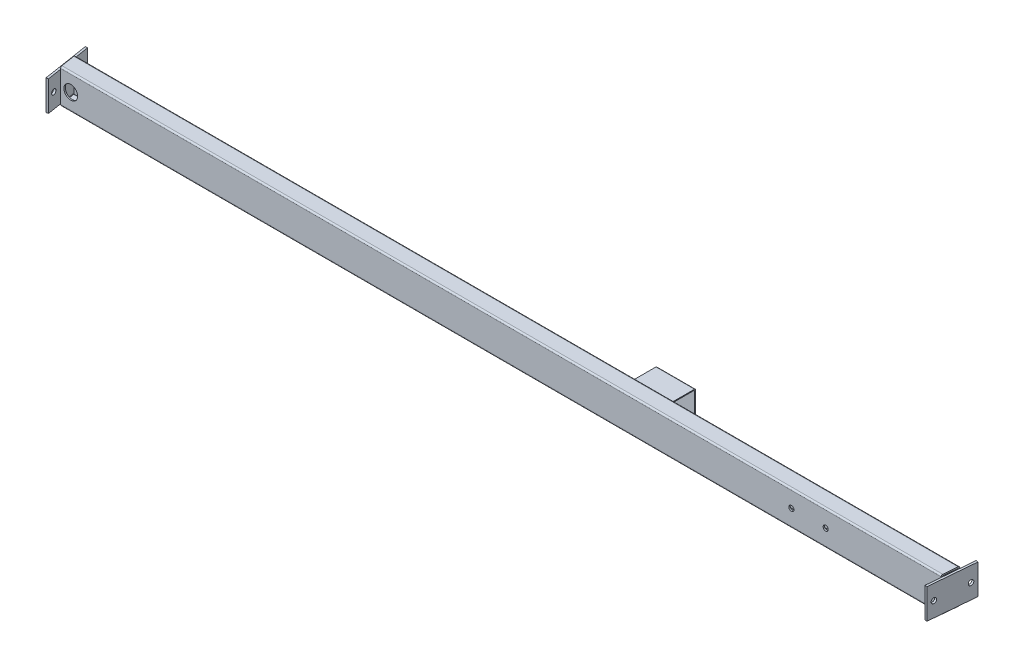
SolidWorks part; units mm, degrees
ref_plane "Plan de face" through (0, 0, 0) normal (0, 0, 1) x (1, 0, 0)
ref_plane "Plan de dessus" through (0, 0, 0) normal (0, 1, 0) x (1, 0, 0)
ref_plane "Plan de droite" through (0, 0, 0) normal (1, 0, 0) x (0, 0, -1)
sketch3d "Esquisse3D1"
  line L0 (0, 0, 0) -> (2065, 0, 0)
  dimension "D1" = 2065
other "Elément mécano-soudé1"
ref_plane "Plan1" through (0, 0, 0) normal (1, 0, 0) x (0, 0, -1)
sketch "Sketch1" plane through (0, 0, 0) normal (1, 0, 0) x (0, 0, -1)
  line L0 (-16.5, -36.8) -> (16.5, -36.8)
  line L1 (-16.8, -36.5) -> (-16.8, 36.5)
  line L2 (16.5, 36.8) -> (-16.5, 36.8)
  line L3 (16.8, 36.5) -> (16.8, -36.5)
  line L4 (-16.5, -40) -> (16.5, -40)
  line L5 (-20, -36.5) -> (-20, 36.5)
  line L6 (16.5, 40) -> (-16.5, 40)
  line L7 (20, 36.5) -> (20, -36.5)
  arc A0 (20, 36.5) -> (16.5, 40) centre (16.5, 36.5) ccw
  arc A1 (16.5, -40) -> (20, -36.5) centre (16.5, -36.5) ccw
  arc A2 (-20, -36.5) -> (-16.5, -40) centre (-16.5, -36.5) ccw
  arc A3 (-16.5, 40) -> (-20, 36.5) centre (-16.5, 36.5) ccw
  arc A4 (-16.5, 36.8) -> (-16.8, 36.5) centre (-16.5, 36.5) ccw
  arc A5 (16.8, 36.5) -> (16.5, 36.8) centre (16.5, 36.5) ccw
  arc A6 (16.5, -36.8) -> (16.8, -36.5) centre (16.5, -36.5) ccw
  arc A7 (-16.8, -36.5) -> (-16.5, -36.8) centre (-16.5, -36.5) ccw
  point P0 (0, 40)
  point P1 (20, 0)
  point P2 (0, -40)
  point P3 (-20, 0)
  point P4 (-20, 40)
  point P5 (20, 40)
  point P6 (20, -40)
  point P7 (-20, -40)
  point P8 (0, 0)
  point P33 (0, 0)
  dimension "D1" = 3.5
  dimension "Thickness" = 3.2
  dimension "V_leg" = 80
  dimension "H_leg" = 40
ref_plane "Plan2" through (2047.5775, 0, 179.1398) normal (0.9962, 0, 0.0872) x (0.0872, 0, -0.9962)
sketch "Esquisse2" plane through (2047.5775, 0, 179.1398) normal (0.9962, 0, 0.0872) x (0.0872, 0, -0.9962)
  line L0 (199.9005, -36.5) -> (199.9005, 36.5) construction
  line L1 (229.9005, 70) -> (130.0527, 70)
  line L2 (229.9005, 70) -> (229.9005, -70)
  line L3 (229.9005, -70) -> (130.0527, -70)
  line L4 (130.0527, 70) -> (130.0527, -70)
  line L5 (163.5394, -40) -> (196.4138, -40) construction
  line L6 (196.4138, 40) -> (163.5394, 40) construction
  line L7 (160.0527, 36.5) -> (160.0527, -36.5) construction
  point P6 (179.9766, -40)
  dimension "D1" = 30
  dimension "D2" = 30
  dimension "D3" = 30
  dimension "D4" = 30
extrude "Enlèv. mat.-Extru.1" cut sketch "Esquisse2" along normal blind 10
ref_plane "Plan3" through (3.0902, 0, -0.4894) normal (-0.9877, 0, 0.1564) x (0.1564, 0, 0.9877)
sketch "Esquisse3" plane through (3.0902, 0, -0.4894) normal (-0.9877, 0, 0.1564) x (0.1564, 0, 0.9877)
  line L0 (19.7538, 36.5) -> (19.7538, -36.5) construction
  line L1 (-49.7538, 70) -> (49.7538, 70)
  line L2 (-49.7538, 70) -> (-49.7538, -70)
  line L3 (-49.7538, -70) -> (49.7538, -70)
  line L4 (49.7538, 70) -> (49.7538, -70)
  line L5 (16.2969, -40) -> (-16.2969, -40) construction
  line L6 (-16.2969, 40) -> (16.2969, 40) construction
  line L7 (-19.7538, -36.5) -> (-19.7538, 36.5) construction
  dimension "D1" = 30
  dimension "D2" = 30
  dimension "D3" = 30
  dimension "D4" = 30
extrude "Enlèv. mat.-Extru.3" cut sketch "Esquisse3" along normal blind 208
sketch "Esquisse4" plane through (3.0902, 0, -0.4894) normal (-0.9877, 0, 0.1564) x (0.1564, 0, 0.9877)
  line L1 (-55, -35) -> (55, -35)
  line L2 (-55, -35) -> (-55, 35)
  line L3 (-55, 35) -> (55, 35)
  line L4 (55, -35) -> (55, 35)
  circle A0 centre (-40, 0) radius 6
  circle A1 centre (40, 0) radius 6
  dimension "D5" = 12
  dimension "D1" = 70
  dimension "D2" = 110
  dimension "D3" = 55
  dimension "D4" = 35
  dimension "D6" = 15
  dimension "D7" = 15
extrude "Boss.-Extru.1" add sketch "Esquisse4" along normal blind 5 separate body
sketch "Esquisse5" plane through (2047.5775, 0, 179.1398) normal (0.9962, 0, 0.0872) x (0.0872, 0, -0.9962)
  line L1 (234.9766, 35) -> (124.9766, 35)
  line L2 (234.9766, 35) -> (234.9766, -35)
  line L3 (234.9766, -35) -> (124.9766, -35)
  line L4 (124.9766, 35) -> (124.9766, -35)
  circle A0 centre (219.9766, 0) radius 6
  circle A1 centre (139.9766, 0) radius 6
  dimension "D5" = 12
  dimension "D1" = 70
  dimension "D2" = 110
  dimension "D3" = 35
  dimension "D4" = 55
  dimension "D6" = 15
  dimension "D7" = 15
extrude "Boss.-Extru.2" add sketch "Esquisse5" along normal blind 5 separate body
sketch "Esquisse6" plane through (0, 0, -20) normal (0, 0, -1) x (-1, 0, 0)
  line L0 (-2065, -36.5) -> (-2065, 36.5) construction
  line L1 (-2064.6938, -40) -> (-0.5543, -40) construction
  line L2 (0, -36.5) -> (0, 36.5) construction
  circle A0 centre (-1792, 0) radius 6
  circle A1 centre (-1712, 0) radius 6
  circle A2 centre (-30, 0) radius 16
  dimension "D2" = 12
  dimension "D5" = 32
  dimension "D1" = 273
  dimension "D3" = 80
  dimension "D4" = 40
  dimension "D6" = 30
  dimension "D7" = 40
extrude "Enlèv. mat.-Extru.4" cut sketch "Esquisse6" against normal through all
sketch3d "Esquisse3D2"
  line L0 (1298, 0, -50) -> (1388, 0, -50)
  line L1 (1388, 0, -50) -> (1388, 0, -5.0818) construction
  line L2 (2065, 0, -20) -> (2065, 0, -98.5396) construction
  line L4 (2065, -36.5, -20) -> (2065, 36.5, -20) construction
  dimension "D1" = 30
  dimension "D3" = 677
  dimension "D2" = 40
  dimension "D4" = 90
other "Elément mécano-soudé2"
ref_plane "Plan4" through (1298, 0, -50) normal (1, 0, 0) x (0, 0, -1)
sketch "Sketch12" plane through (1298, 0, -50) normal (1, 0, 0) x (0, 0, -1)
  line L0 (-27.8, -28) -> (27.8, -28)
  line L1 (-28, -27.8) -> (-28, 27.8)
  line L2 (27.8, 28) -> (-27.8, 28)
  line L3 (28, 27.8) -> (28, -27.8)
  line L4 (-27.8, -30) -> (27.8, -30)
  line L5 (-30, -27.8) -> (-30, 27.8)
  line L6 (27.8, 30) -> (-27.8, 30)
  line L7 (30, 27.8) -> (30, -27.8)
  arc A0 (30, 27.8) -> (27.8, 30) centre (27.8, 27.8) ccw
  arc A1 (27.8, -30) -> (30, -27.8) centre (27.8, -27.8) ccw
  arc A2 (-30, -27.8) -> (-27.8, -30) centre (-27.8, -27.8) ccw
  arc A3 (-27.8, 30) -> (-30, 27.8) centre (-27.8, 27.8) ccw
  arc A4 (-27.8, 28) -> (-28, 27.8) centre (-27.8, 27.8) ccw
  arc A5 (28, 27.8) -> (27.8, 28) centre (27.8, 27.8) ccw
  arc A6 (27.8, -28) -> (28, -27.8) centre (27.8, -27.8) ccw
  arc A7 (-28, -27.8) -> (-27.8, -28) centre (-27.8, -27.8) ccw
  point P0 (-30, 0)
  point P1 (30, 0)
  point P2 (0, 30)
  point P3 (0, -30)
  point P4 (0, 0)
  point P5 (-30, -30)
  point P6 (30, -30)
  point P7 (30, 30)
  point P8 (-30, 30)
  point P33 (0, 0)
  dimension "D1" = 2.2
  dimension "Thickness" = 2
  dimension "V_leg" = 60
sketch "Esquisse9" plane through (0, -30, 0) normal (0, -1, 0) x (1, 0, 0)
  line L0 (1388, -80) -> (1298, -80) construction
  line L1 (1298, -22.2) -> (1298, -77.8) construction
  circle A0 centre (1343, -50) radius 10
  dimension "D1" = 20
  dimension "D2" = 30
  dimension "D3" = 45
extrude "Enlèv. mat.-Extru.5" cut sketch "Esquisse9" against normal up to next (2 mm away)
sketch "Esquisse10" plane through (0, -30, 0) normal (0, -1, 0) x (1, 0, 0)
  line L0 (1388, -22.2) -> (1388, -77.8) construction
  line L1 (1333, -44.2265) -> (1333, -55.7735)
  line L2 (1333, -55.7735) -> (1343, -61.547)
  line L3 (1343, -61.547) -> (1353, -55.7735)
  line L4 (1353, -55.7735) -> (1353, -44.2265)
  line L5 (1353, -44.2265) -> (1343, -38.453)
  line L6 (1343, -38.453) -> (1333, -44.2265)
  circle A0 centre (1343, -50) radius 10 construction
  circle A1 centre (1343, -50) radius 8
  dimension "D1" = 16
  dimension "D2" = 20
extrude "Boss.-Extru.3" add sketch "Esquisse10" along normal blind 15 separate body
